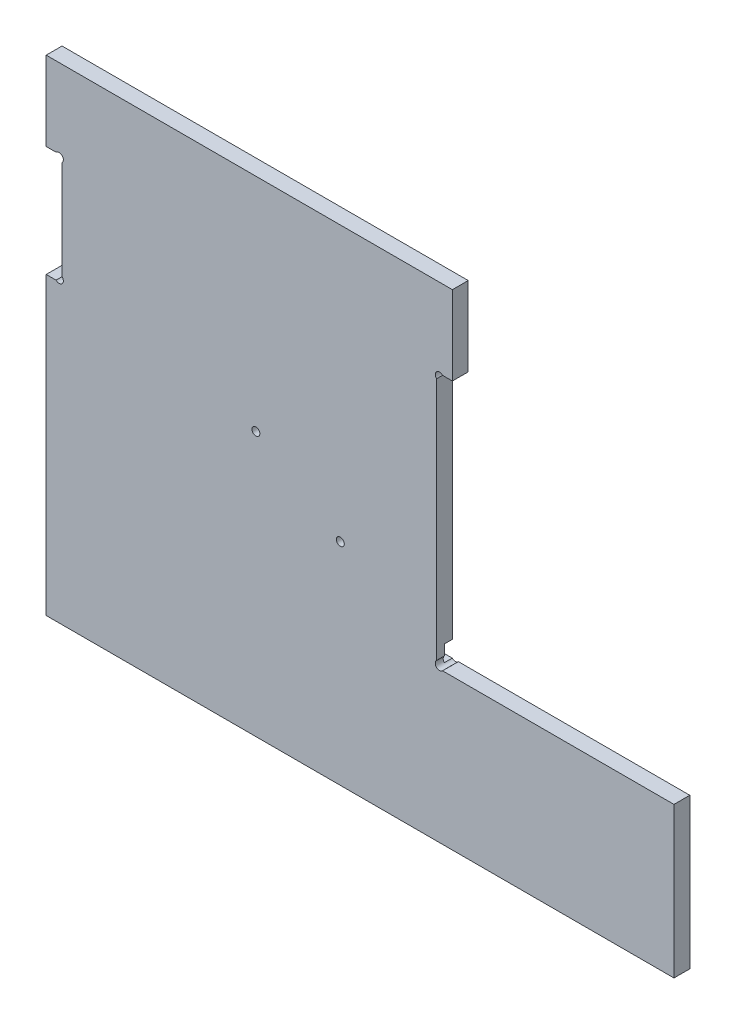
SolidWorks part; units mm, degrees
ref_plane "Face" through (0, 0, 0) normal (0, 0, 1) x (1, 0, 0)
ref_plane "Dessus" through (0, 0, 0) normal (0, 1, 0) x (1, 0, 0)
ref_plane "Droite" through (0, 0, 0) normal (1, 0, 0) x (0, 0, -1)
sketch "Esquisse1" plane through (0, 0, 0) normal (0, 0, 1) x (1, 0, 0)
  line L0 (132.8174, -51.0303) -> (222.8174, -51.0303)
  line L1 (-15.1826, 75.9697) -> (132.8174, 75.9697)
  line L2 (-15.1826, 75.9697) -> (-15.1826, -108.0303)
  line L3 (118.8174, -108.0303) -> (-15.1826, -108.0303)
  line L4 (132.8174, 75.9697) -> (132.8174, -51.0303)
  line L5 (222.8174, -51.0303) -> (222.8174, -108.0303)
  line L6 (222.8174, -108.0303) -> (118.8174, -108.0303)
  dimension "D1" = 184
  dimension "D2" = 238
  dimension "D4" = 57
  dimension "D7" = 90
extrude "Base-Extrusion" add sketch "Esquisse1" along normal blind 6
sketch "escalier" plane through (0, 0, 0) normal (0, 0, -1) x (-1, 0, 0)
  line L0 (-222.8174, -51.0303) -> (-132.8174, -51.0303) construction
  line L1 (-113.8174, -24.8303) -> (-78.8174, -24.8303)
  line L2 (-113.8174, -24.8303) -> (-113.8174, -31.0303)
  line L4 (-78.8174, -24.8303) -> (-78.8174, -31.0303)
  line L5 (-113.8174, -31.0303) -> (-78.8174, -31.0303)
  line L9 (-81.8174, -4.8303) -> (-46.8174, -4.8303)
  line L10 (-81.8174, -4.8303) -> (-81.8174, -11.0303)
  line L12 (-46.8174, -4.8303) -> (-46.8174, -11.0303)
  line L13 (-81.8174, -11.0303) -> (-46.8174, -11.0303)
  line L15 (-49.8174, 15.3697) -> (15.1826, 15.3697)
  line L16 (-49.8174, 8.9697) -> (15.1826, 8.9697)
  line L17 (15.1826, 75.9697) -> (15.1826, -108.0303) construction
  line L18 (-49.8174, 15.3697) -> (-49.8174, 8.9697)
  line L20 (15.1826, 15.3697) -> (15.1826, 8.9697)
  line L22 (-222.8174, -108.0303) -> (-222.8174, -51.0303) construction
  line L23 (-132.8174, -51.0303) -> (-110.8174, -51.0303)
  line L25 (-132.8174, -51.0303) -> (-132.8174, -44.8303)
  line L26 (-132.8174, -44.8303) -> (-110.8174, -44.8303)
  line L27 (-110.8174, -51.0303) -> (-110.8174, -44.8303)
  dimension "D1" = 35
  dimension "D2" = 6.2
  dimension "D3" = 3
  dimension "D4" = 109
  dimension "D5" = 20
  dimension "D6" = 3
  dimension "D7" = 20
  dimension "D8" = 3
  dimension "D9" = 35
  dimension "D10" = 20
  dimension "D11" = 6.4
  dimension "D12" = 6.2
  dimension "D19" = 6.2
extrude "Enlèv. mat.-Extru.2" cut sketch "escalier" against normal blind 3
sketch "Esquisse3" plane through (0, 0, 0) normal (0, 0, -1) x (-1, 0, 0)
  line L2 (-113.8174, -24.8303) -> (-113.8174, -31.0303) construction
  line L6 (-81.8174, -4.8303) -> (-46.8174, -4.8303) construction
  line L7 (-46.8174, -4.8303) -> (-46.8174, -11.0303) construction
  line L14 (-113.8174, -31.0303) -> (-78.8174, -31.0303) construction
  circle A1 centre (-96.3174, -28.0303) radius 1.5
  circle A3 centre (-64.3174, -7.8303) radius 1.5
  dimension "D5" = 3
  dimension "D10" = 3
  dimension "D3" = 3
  dimension "D6" = 17.5
  dimension "D11" = 3
  dimension "D12" = 17.5
extrude "Enlèv. mat.-Extru.1" cut sketch "Esquisse3" against normal up to vertex
sketch "Esquisse7" plane through (132.8174, 0, 0) normal (1, 0, 0) x (0, 0, -1)
  line L0 (0, -44.8303) -> (0, 75.9697) construction
  line L1 (-6, 75.9697) -> (0, 75.9697)
  line L2 (-6, 75.9697) -> (-6, 45.9697)
  line L3 (-6, 45.9697) -> (0, 45.9697)
  line L4 (0, 75.9697) -> (0, 45.9697)
  dimension "D1" = 30
extrude "Extrusion1" add sketch "Esquisse7" along normal blind 6
sketch "Esquisse9" plane through (0, 0, 0) normal (0, 0, -1) x (-1, 0, 0)
  line L0 (15.1826, 75.9697) -> (15.1826, 15.3697) construction
  line L1 (15.1826, 45.9697) -> (9.1826, 45.9697)
  line L2 (15.1826, 45.9697) -> (15.1826, 3.9697)
  line L3 (15.1826, 3.9697) -> (9.1826, 3.9697)
  line L4 (9.1826, 45.9697) -> (9.1826, 3.9697)
  line L5 (-138.8174, 75.9697) -> (15.1826, 75.9697) construction
  dimension "D1" = 6
  dimension "D2" = 42
  dimension "D3" = 30
extrude "Enlèv. mat.-Extru.5" cut sketch "Esquisse9" against normal up to vertex (6 mm away)
sketch "Esquisse4" plane through (0, 0, 0) normal (0, 0, -1) x (-1, 0, 0)
  line L0 (-113.8174, -24.8303) -> (-113.8174, -31.0303) construction
  line L1 (-113.8174, -31.0303) -> (-78.8174, -31.0303) construction
  line L2 (-78.8174, -24.8303) -> (-113.8174, -24.8303) construction
  line L3 (-78.8174, -31.0303) -> (-78.8174, -24.8303) construction
  line L4 (-46.8174, -11.0303) -> (-46.8174, -4.8303) construction
  line L5 (-81.8174, -4.8303) -> (-81.8174, -11.0303) construction
  line L6 (-46.8174, -4.8303) -> (-81.8174, -4.8303) construction
  line L7 (-81.8174, -11.0303) -> (-46.8174, -11.0303) construction
  line L8 (-49.8174, 15.3697) -> (-49.8174, 8.9697) construction
  line L9 (9.1826, 15.3697) -> (-49.8174, 15.3697) construction
  line L10 (-110.8174, -51.0303) -> (-110.8174, -44.8303) construction
  line L11 (-49.8174, 8.9697) -> (9.1826, 8.9697) construction
  line L12 (-110.8174, -44.8303) -> (-132.8174, -44.8303) construction
  line L13 (-222.8174, -51.0303) -> (-110.8174, -51.0303) construction
  circle A0 centre (-112.7174, -25.9303) radius 1.6
  circle A1 centre (-112.7174, -29.9303) radius 1.6
  circle A2 centre (-79.9174, -25.9303) radius 1.6
  circle A3 centre (-79.9174, -29.9303) radius 1.6
  circle A4 centre (-47.9174, -5.9303) radius 1.6
  circle A5 centre (-80.7174, -5.9303) radius 1.6
  circle A6 centre (-47.9174, -9.9303) radius 1.6
  circle A7 centre (-80.7174, -9.9303) radius 1.6
  circle A8 centre (-48.7174, 14.2697) radius 1.6
  circle A9 centre (-111.9174, -45.9303) radius 1.6
  circle A10 centre (-48.7174, 10.0697) radius 1.6
  circle A11 centre (-111.9174, -49.9303) radius 1.6
  dimension "D1" = 1.1
  dimension "D9" = 1.1
  dimension "D13" = 1.1
  dimension "D17" = 1.1
  dimension "D23" = 1.1
  dimension "D19" = 1.1
  dimension "D2" = 1.1
  dimension "D3" = 1.1
  dimension "D4" = 1.1
  dimension "D5" = 1.1
  dimension "D6" = 1.1
  dimension "D7" = 1.1
  dimension "D8" = 1.1
  dimension "D10" = 1.1
  dimension "D11" = 1.1
  dimension "D12" = 1.1
  dimension "D14" = 1.1
  dimension "D15" = 1.1
  dimension "D16" = 1.1
  dimension "D18" = 1.1
  dimension "D20" = 1.1
  dimension "D21" = 1.1
  dimension "D22" = 1.1
  dimension "D24" = 1.1
extrude "Enlèv. mat.-Extru.3" cut sketch "Esquisse4" against normal up to vertex (3 mm away)
sketch "Esquisse6" plane through (0, 0, 0) normal (0, 0, -1) x (-1, 0, 0)
  line L0 (-222.8174, -51.0303) -> (-113.0793, -51.0303) construction
  line L1 (-132.8174, -44.8303) -> (-132.8174, 45.9697) construction
  line L2 (-132.8174, -44.8303) -> (-132.8174, 45.9697) construction
  line L3 (-138.8174, 45.9697) -> (-132.8174, 45.9697) construction
  line L4 (15.1826, 45.9697) -> (9.1826, 45.9697) construction
  line L5 (9.1826, 45.9697) -> (9.1826, 15.3697) construction
  line L6 (9.1826, 8.9697) -> (9.1826, 3.9697) construction
  line L7 (9.1826, 3.9697) -> (15.1826, 3.9697) construction
  circle A0 centre (-133.9174, -49.9303) radius 1.6
  circle A1 centre (-133.9174, 44.8697) radius 1.6
  circle A2 centre (10.2826, 44.8697) radius 1.6
  circle A3 centre (10.2826, 5.0697) radius 1.6
  dimension "D1" = 1.1
  dimension "D3" = 1.1
  dimension "D5" = 1.1
  dimension "D7" = 1.1
  dimension "D2" = 1.1
  dimension "D4" = 1.1
  dimension "D6" = 1.1
  dimension "D8" = 1.1
extrude "Enlèv. mat.-Extru.4" cut sketch "Esquisse6" against normal up to vertex (6 mm away)
